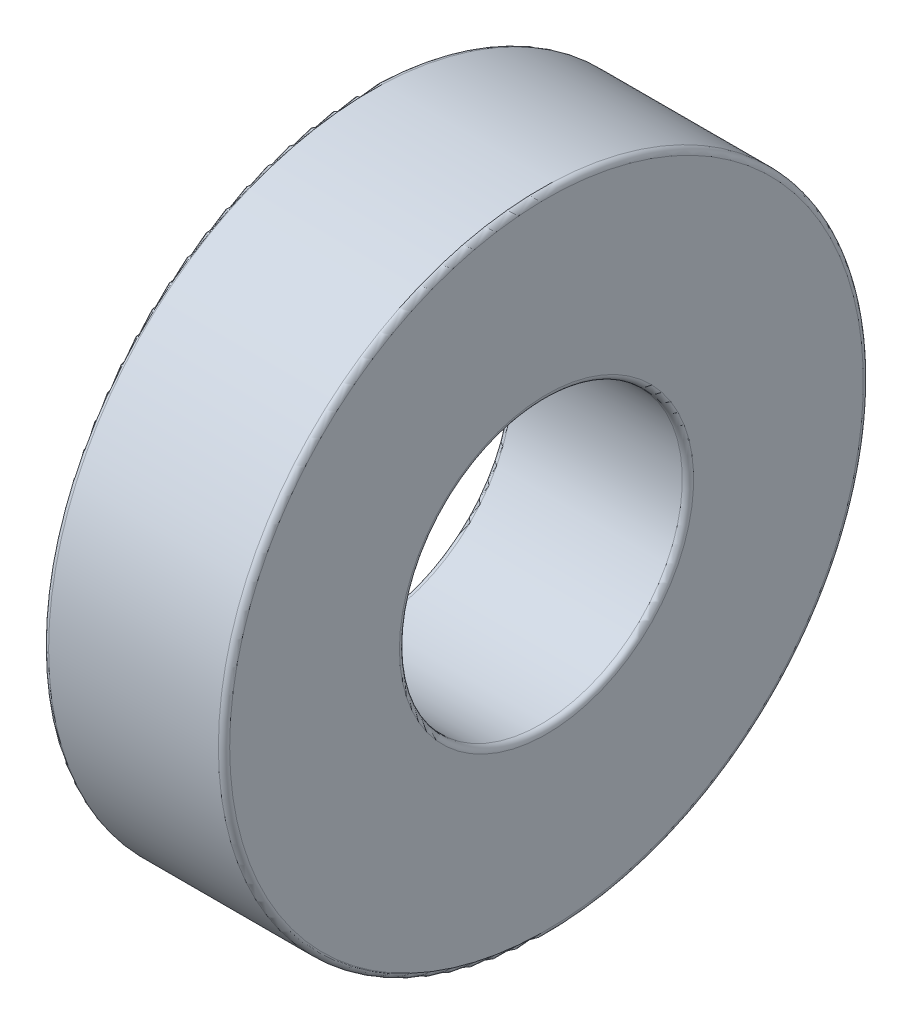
SolidWorks part; units mm, degrees
ref_plane "Plan de face" through (0, 0, 0) normal (0, 0, 1) x (1, 0, 0)
ref_plane "Plan de dessus" through (0, 0, 0) normal (0, 1, 0) x (1, 0, 0)
ref_plane "Plan de droite" through (0, 0, 0) normal (1, 0, 0) x (0, 0, -1)
sketch "Esquisse1" plane through (0, 0, 0) normal (0, 0, 1) x (1, 0, 0)
  line L0 (0.5, 12.5) -> (15.5, 12.5)
  line L1 (16, 13) -> (16, 28)
  line L2 (15.5, 28.5) -> (0.5, 28.5)
  line L3 (0, 28) -> (0, 13)
  line L4 (0, 0) -> (24.8997, 0) construction
  arc A0 (0.5, 28.5) -> (0, 28) centre (0.5, 28) ccw
  arc A1 (16, 28) -> (15.5, 28.5) centre (15.5, 28) ccw
  arc A2 (16, 13) -> (15.5, 12.5) centre (15.5, 13) cw
  arc A3 (0, 13) -> (0.5, 12.5) centre (0.5, 13) ccw
  point P9 (0, 28.5)
  point P12 (16, 28.5)
  dimension "D4" = 0.5
  dimension "D1" = 16
  dimension "D2" = 12.5
  dimension "D3" = 28.5
revolve "Révolution1" add sketch "Esquisse1" angle 360 about L4
